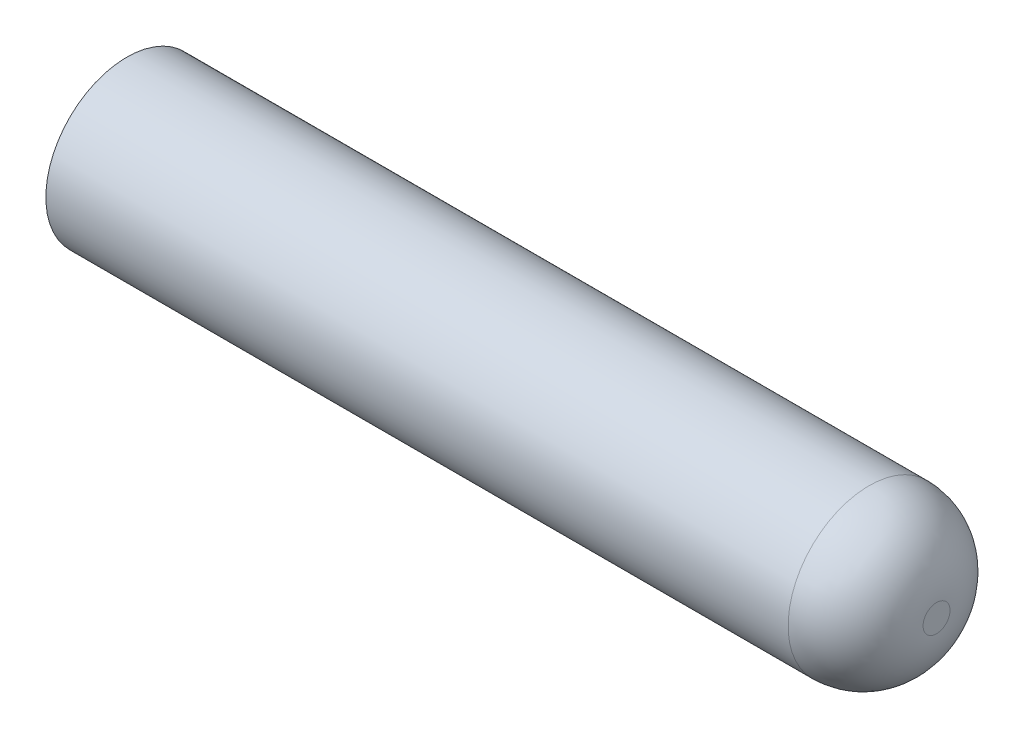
SolidWorks part; units mm, degrees
ref_plane "Front Plane" through (0, 0, 0) normal (0, 0, 1) x (1, 0, 0)
ref_plane "Top Plane" through (0, 0, 0) normal (0, 1, 0) x (1, 0, 0)
ref_plane "Right Plane" through (0, 0, 0) normal (1, 0, 0) x (0, 0, -1)
sketch "Sketch1" plane through (0, 0, 0) normal (1, 0, 0) x (0, 0, -1)
  circle A0 centre (0, 0) radius 3
  dimension "D1" = 6
extrude "Extrude1" add sketch "Sketch1" along normal blind 30
fillet "Fillet1" radius 2.5 1 edges at (30, 0, -3)
sketch "Sketch2" plane through (0, 0, 0) normal (-1, 0, 0) x (0, 0, 1)
  circle A0 centre (0, 0) radius 1.5
  dimension "D1" = 3
extrude "Extrude2" cut sketch "Sketch2" against normal blind 10
